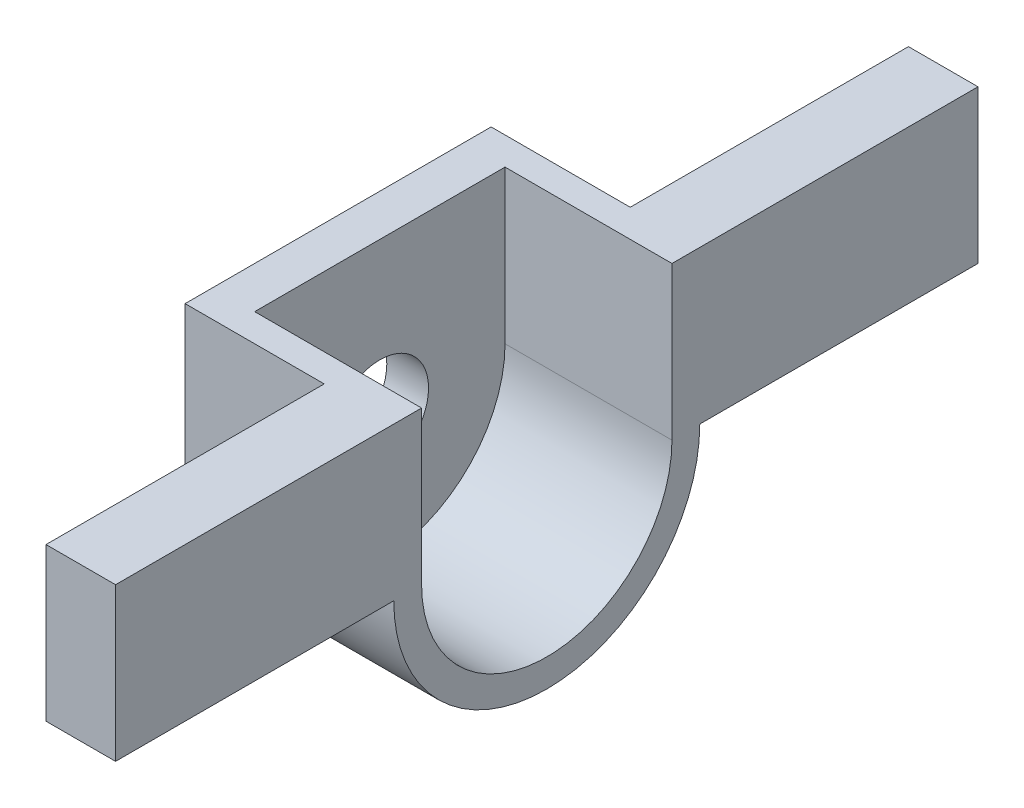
SolidWorks part; units mm, degrees
ref_plane "Front Plane" through (0, 0, 0) normal (0, 0, 1) x (1, 0, 0)
ref_plane "Top Plane" through (0, 0, 0) normal (0, 1, 0) x (1, 0, 0)
ref_plane "Right Plane" through (0, 0, 0) normal (1, 0, 0) x (0, 0, -1)
sketch "Sketch1" plane through (0, 0, 0) normal (1, 0, 0) x (0, 0, -1)
  line L2 (-11, 0) -> (-11, 11)
  line L3 (-11, 11) -> (11, 11)
  line L4 (11, 0) -> (11, 11)
  arc A0 (-11, 0) -> (11, 0) centre (0, 0) ccw
  dimension "D1" = 22
  dimension "D2" = 11
extrude "Boss-Extrude2" add sketch "Sketch1" along normal blind 15
sketch "Sketch2" plane through (15, 0, 0) normal (1, 0, 0) x (0, 0, -1)
  line L0 (11, 11) -> (-11, 11) construction
  line L2 (-9, 0) -> (-9, 11)
  line L3 (-9, 11) -> (9, 11)
  line L4 (9, 0) -> (9, 11)
  arc A0 (-9, 0) -> (9, 0) centre (0, 0) ccw
  dimension "D1" = 18
extrude "Cut-Extrude1" cut sketch "Sketch2" against normal blind 12 contours A0 L4 L3 L2
sketch "Sketch3" plane through (3, 0, 0) normal (1, 0, 0) x (0, 0, -1)
  circle A0 centre (0, 0) radius 3.5
  dimension "D1" = 7
extrude "Cut-Extrude2" cut sketch "Sketch3" against normal through all contours A0
sketch "Sketch4" plane through (0, 0, -11) normal (0, 0, -1) x (-1, 0, 0)
  line L0 (-15, 0) -> (0, 0) construction
  line L1 (-15, 11) -> (-10, 11)
  line L2 (-15, 11) -> (-15, 0)
  line L3 (-15, 0) -> (-10, 0)
  line L4 (-10, 11) -> (-10, 0)
  dimension "D1" = 5
extrude "Boss-Extrude3" add sketch "Sketch4" along normal blind 20 contours L2 L1 L4 L3
sketch "Sketch5" plane through (0, 0, 11) normal (0, 0, 1) x (1, 0, 0)
  line L0 (15, 0) -> (0, 0) construction
  line L1 (15, 11) -> (10, 11)
  line L2 (15, 11) -> (15, 0)
  line L3 (15, 0) -> (10, 0)
  line L4 (10, 11) -> (10, 0)
  dimension "D1" = 5
extrude "Boss-Extrude4" add sketch "Sketch5" along normal blind 20 contours L2 L1 L4 L3
